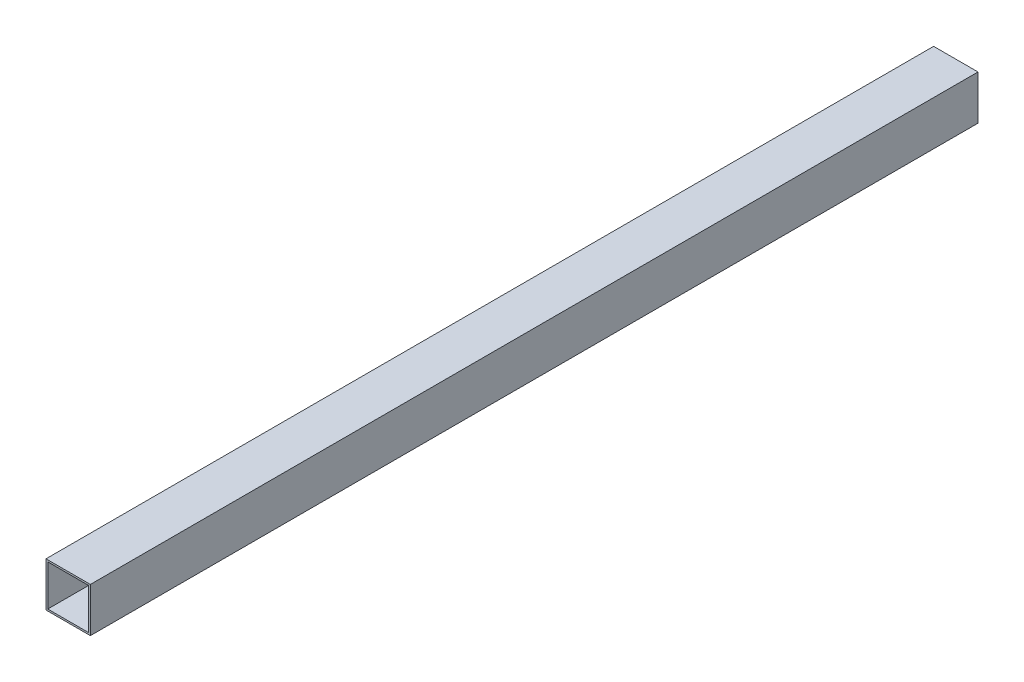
SolidWorks part; units mm, degrees
ref_plane "Piano frontale" through (0, 0, 0) normal (0, 0, 1) x (1, 0, 0)
ref_plane "Piano superiore" through (0, 0, 0) normal (0, 1, 0) x (1, 0, 0)
ref_plane "Piano destro" through (0, 0, 0) normal (1, 0, 0) x (0, 0, -1)
sketch "Schizzo1" plane through (0, 0, 0) normal (0, 0, 1) x (1, 0, 0)
  line L1 (-15, -15) -> (15, -15)
  line L2 (-15, -15) -> (-15, 15)
  line L3 (-15, 15) -> (15, 15)
  line L4 (15, -15) -> (15, 15)
  line L5 (-15, -15) -> (15, 15) construction
  line L6 (-15, 15) -> (15, -15) construction
  point P0 (0, 0)
  dimension "D1" = 30
  dimension "D2" = 30
extrude "Estrusione-Sottile1" add sketch "Schizzo1" along normal blind 600 thin
